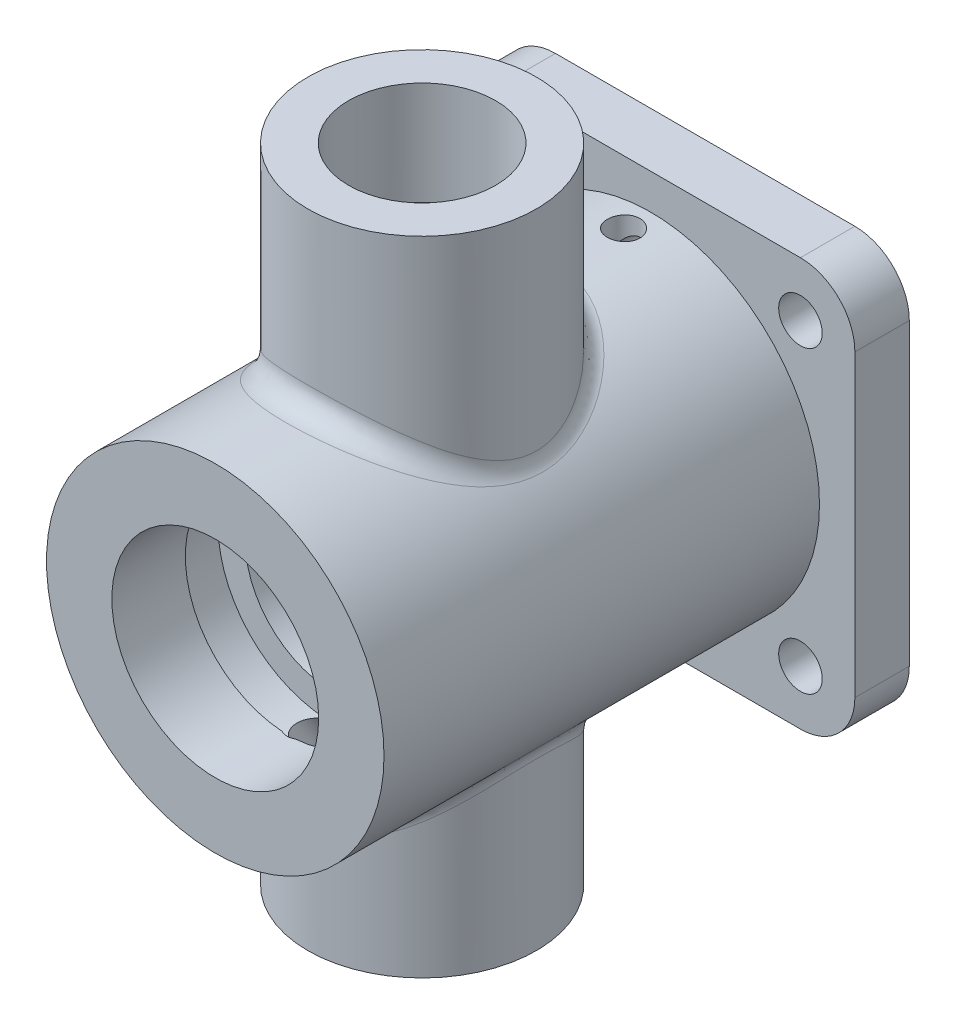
SolidWorks part; units mm, degrees
ref_plane "Plan1" through (0, 0, 0) normal (0, 0, 1) x (1, 0, 0)
ref_plane "Plan2" through (0, 0, 0) normal (0, 1, 0) x (1, 0, 0)
ref_plane "Plan3" through (0, 0, 0) normal (1, 0, 0) x (0, 0, -1)
sketch "Esquisse1" plane through (0, 0, 0) normal (0, 0, 1) x (1, 0, 0)
  circle A0 centre (0, 0) radius 31
extrude "Base-Extrusion" add sketch "Esquisse1" along normal blind 80
sketch "Esquisse2" plane through (0, 0, 0) normal (0, 1, 0) x (1, 0, 0)
  line L0 (0, -80) -> (0, 0) construction
  circle A0 centre (0, -42) radius 21
  dimension "D1" = 42
  dimension "D2" = 42
extrude "Boss.-Extru.1" add sketch "Esquisse2" against normal mid plane 126
sketch "Esquisse3" plane through (0, 0, 0) normal (0, 0, -1) x (-1, 0, 0)
  line L1 (-27.5, 37.5) -> (27.5, 37.5)
  line L2 (-37.5, 27.5) -> (-37.5, -27.5)
  line L3 (-27.5, -37.5) -> (27.5, -37.5)
  line L4 (37.5, 27.5) -> (37.5, -27.5)
  arc A0 (-37.5, 27.5) -> (-27.5, 37.5) centre (-27.5, 27.5) cw
  arc A1 (-27.5, -37.5) -> (-37.5, -27.5) centre (-27.5, -27.5) cw
  arc A2 (37.5, -27.5) -> (27.5, -37.5) centre (27.5, -27.5) cw
  arc A3 (27.5, 37.5) -> (37.5, 27.5) centre (27.5, 27.5) cw
  circle A4 centre (-27.5, 27.5) radius 4
  circle A5 centre (-27.5, -27.5) radius 4
  circle A6 centre (27.5, -27.5) radius 4
  circle A7 centre (27.5, 27.5) radius 4
  point P7 (-37.5, 37.5)
  point P12 (37.5, -37.5)
  point P15 (37.5, 37.5)
  dimension "D5" = 10
  dimension "D6" = 8
  dimension "D7" = 8
  dimension "D8" = 8
  dimension "D9" = 8
  dimension "D1" = 37.5
  dimension "D2" = 75
  dimension "D3" = 37.5
  dimension "D4" = 75
extrude "Boss.-Extru.2" add sketch "Esquisse3" along normal blind 10
sketch "Esquisse4" plane through (0, 0, 0) normal (1, 0, 0) x (0, 0, -1)
  line L0 (0, 0) -> (34.0836, 0) construction
  line L1 (-80, 0) -> (0, 0) construction
  line L2 (10, 22) -> (18, 22)
  line L3 (10, 27.5) -> (10, -27.5) construction
  line L4 (18, 22) -> (18, 12)
  line L5 (18, 12) -> (26, 12)
  line L6 (26, 12) -> (26, 0)
  line L7 (10, 22) -> (10, 0)
  line L8 (26, 0) -> (10, 0)
  dimension "D1" = 24
  dimension "D2" = 44
  dimension "D3" = 8
  dimension "D4" = 8
revolve "Boss.-Révol.1" add sketch "Esquisse4" angle 360 about L0
sketch "Esquisse5" plane through (0, 0, 0) normal (1, 0, 0) x (0, 0, -1)
  line L0 (0, 0) -> (-89.6762, 0) construction
  line L1 (-80, 0) -> (0, 0) construction
  line L2 (-84.5, 0) -> (-84.5, 19)
  line L3 (-84.5, 19) -> (-66.5, 19)
  line L4 (-66.5, 19) -> (-66.5, 21)
  line L5 (-66.5, 21) -> (-58.5, 21)
  line L6 (-58.5, 21) -> (-58.5, 16)
  line L7 (-58.5, 16) -> (-8, 16)
  line L8 (-8, 16) -> (-8, 18)
  line L9 (-84.5, 0) -> (0, 0)
  line L10 (-8, 18) -> (0, 18)
  line L11 (0, 27.5) -> (0, -27.5) construction
  line L12 (0, 18) -> (0, 0)
  dimension "D1" = 32
  dimension "D2" = 18
  dimension "D3" = 8
  dimension "D4" = 18
  dimension "D5" = 42
  dimension "D6" = 38
  dimension "D7" = 8
  dimension "D8" = 58.5
revolve "Enlèvement de matière-Révolution1" cut sketch "Esquisse5" angle 360 about L0
fillet "Congé1" radius 4
sketch "Esquisse7" plane through (0, 0, 0) normal (1, 0, 0) x (0, 0, -1)
  line L0 (-42, 9.032) -> (-42, 67.7403) construction
  line L1 (-42, -34.9999) -> (-42, -63) construction
  line L2 (-55.5, 68) -> (-55.5, 44)
  line L3 (-55.5, 44) -> (-57, 44)
  line L4 (-57, 44) -> (-57, 36)
  line L5 (-57, 36) -> (-42, 36)
  line L6 (-55.5, 68) -> (-42, 68)
  line L7 (-42, 36) -> (-42, 68)
  dimension "D1" = 30
  dimension "D2" = 27
  dimension "D3" = 8
  dimension "D4" = 36
  dimension "D5" = 32
revolve "Enlèvement de matière-Révolution2" cut sketch "Esquisse7" angle 360 about L0
sketch "Esquisse8" plane through (0, 0, 0) normal (1, 0, 0) x (0, 0, -1)
  line L0 (-42, -24.733) -> (-42, -71.8523) construction
  line L1 (-42, -34.9999) -> (-42, -63) construction
  line L2 (-28.5, -68) -> (-28.5, -36)
  line L3 (-28.5, -36) -> (-27, -36)
  line L4 (-27, -36) -> (-27, -28)
  line L5 (-27, -28) -> (-42, -28)
  line L6 (-28.5, -68) -> (-42, -68)
  line L7 (-42, -28) -> (-42, -68)
  dimension "D1" = 8
  dimension "D2" = 28
  dimension "D3" = 32
  dimension "D4" = 30
  dimension "D5" = 27
revolve "Enlèvement de matière-Révolution3" cut sketch "Esquisse8" angle 360 about L0
sketch "Esquisse10" plane through (0, 0, -26) normal (0, 0, -1) x (-1, 0, 0)
  circle A0 centre (0, 0) radius 3
extrude "Enlèv. mat.-Extru.1" cut sketch "Esquisse10" against normal through all
sketch "Esquisse11" plane through (0, 0, 0) normal (1, 0, 0) x (0, 0, -1)
  line L0 (0, 0) -> (29.9502, 0) construction
  line L1 (-80, 0) -> (0, 0) construction
  line L2 (13, 0) -> (13, 6)
  line L3 (13, 6) -> (16, 6)
  line L4 (16, 6) -> (16, 0)
  line L5 (13, 0) -> (16, 0)
  dimension "D1" = 3
  dimension "D2" = 13
  dimension "D3" = 12
revolve "Enlèvement de matière-Révolution4" cut sketch "Esquisse11" angle 360 about L0
hole_wizard "Dégagement pour M11" positions "Esquisse14" profile "Esquisse13" hole size "M1" standard "ISO"
sketch "Esquisse14" plane through (0, 36, 0) normal (0, 1, 0) x (-1, 0, 0)
  circle A0 centre (0, 42) radius 21 construction
  point P0 (0, 42)
sketch "Esquisse13" plane through (0, 36, 42) normal (1, 0, 0) x (0, 0, 1)
  line L0 (0, 0) -> (0, 16.8026)
  line L1 (0, 16.8026) -> (3, 15)
  line L2 (3, 15) -> (3, 0)
  line L5 (3, 0) -> (0, 0)
  line L10 (0, 16.8026) -> (-3, 15) construction
  line L11 (0, -6.35) -> (0, 107.95) construction
  dimension "Diamètre du perçage" = 6
  dimension "Profondeur du perçage" = 15
  dimension "Angle de pointe" = 118
hole_wizard "Dégagement pour M12" positions "Esquisse16" profile "Esquisse15" hole size "M1" standard "ISO"
sketch "Esquisse16" plane through (0, 0, -10) normal (0, 0, -1) x (-1, 0, 0)
  point P0 (0, 25)
  dimension "D1" = 25
sketch "Esquisse15" plane through (0, 25, -10) normal (1, 0, 0) x (0, 1, 0)
  line L0 (0, 0) -> (0, 56.8026)
  line L1 (0, 56.8026) -> (3, 55)
  line L2 (3, 55) -> (3, 0)
  line L5 (3, 0) -> (0, 0)
  line L10 (0, 56.8026) -> (-3, 55) construction
  line L11 (0, -6.35) -> (0, 107.95) construction
  dimension "Diamètre du perçage" = 6
  dimension "Profondeur du perçage" = 55
  dimension "Angle de pointe" = 118
sketch "Esquisse18" plane through (0, 0, 0) normal (0, 0, 1) x (1, 0, 0)
  line L0 (-65.8, 0) -> (69.6, 0) construction
ref_plane "Plan4" through (0, 0, 0) normal (0, 0.829, 0.5592) x (-1, 0, 0)
sketch "Esquisse19" plane through (0, 0, 0) normal (0, 0.829, 0.5592) x (-1, 0, 0)
  line L0 (0, 23.0765) -> (0, 24.0845) construction
  circle A0 centre (0, 63) radius 3
  dimension "D2" = 6
  dimension "D1" = 63
extrude "Enlèv. mat.-Extru.3" cut sketch "Esquisse19" along normal mid plane 50
sketch "Esquisse20" plane through (0, 0, 0) normal (1, 0, 0) x (0, 0, -1)
  line L0 (0, 27.5) -> (0, -27.5) construction
  line L1 (-71.3, -55) -> (-14.5, -55)
  line L2 (-71.3, -55) -> (-71.3, -70)
  line L3 (-71.3, -70) -> (-14.5, -70)
  line L4 (-14.5, -55) -> (-14.5, -70)
  dimension "D1" = 55
  dimension "D2" = 15
extrude "Enlèv. mat.-Extru.4" cut sketch "Esquisse20" against normal mid plane 45
sketch "Esquisse21" plane through (0, 0, 0) normal (0, 1, 0) x (1, 0, 0)
  line L0 (0, 16) -> (0, 26) construction
  circle A0 centre (0, -5) radius 3
  dimension "D2" = 6
  dimension "D1" = 5
extrude "Enlèv. mat.-Extru.5" cut sketch "Esquisse21" along normal blind 35
